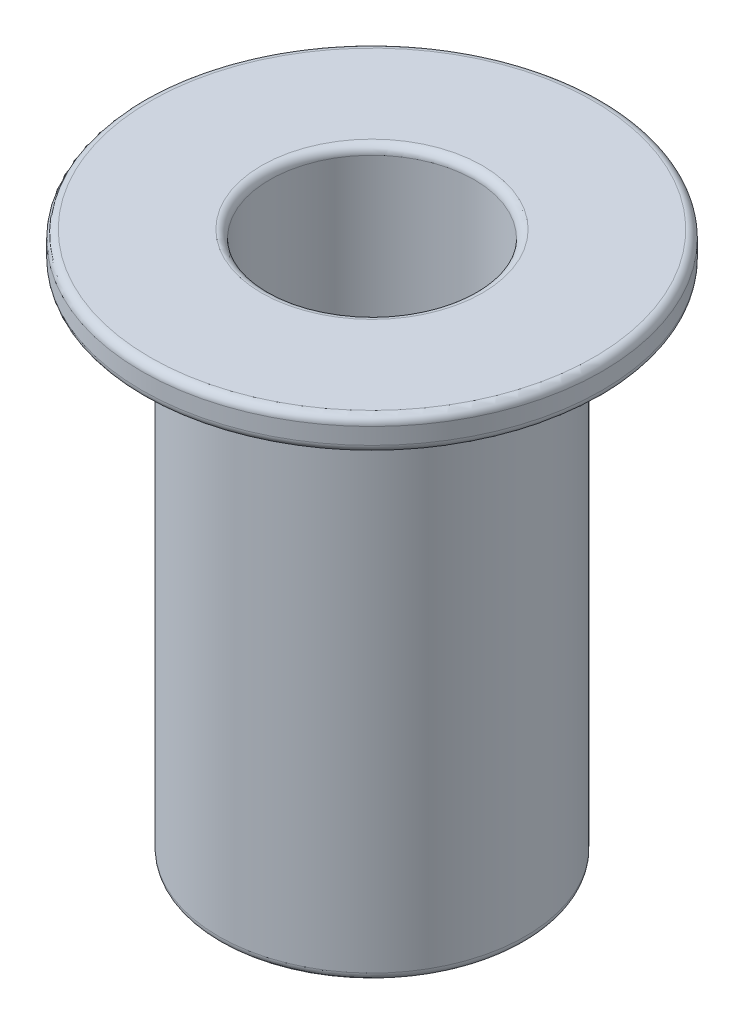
SolidWorks part; units mm, degrees
ref_plane "Front" through (0, 0, 0) normal (0, 0, 1) x (1, 0, 0)
ref_plane "Top" through (0, 0, 0) normal (0, 1, 0) x (1, 0, 0)
ref_plane "Right" through (0, 0, 0) normal (1, 0, 0) x (0, 0, -1)
sketch "Sketch1" plane through (0, 0, 0) normal (0, 1, 0) x (1, 0, 0)
  circle A0 centre (0, 0) radius 7.1438
  dimension "D1" = 14.2875
extrude "Base-Extrude" add sketch "Sketch1" along normal blind 1.016
sketch "Sketch2" plane through (0, 0, 0) normal (0, -1, 0) x (1, 0, 0)
  circle A0 centre (0, 0) radius 4.7625
  dimension "D1" = 9.525
extrude "Boss-Extrude1" add sketch "Sketch2" along normal blind 15.875
sketch "Sketch3" plane through (0, 1.016, 0) normal (0, 1, 0) x (-1, 0, 0)
  circle A0 centre (0, 0) radius 3.175
  dimension "D1" = 6.35
extrude "Cut-Extrude1" cut sketch "Sketch3" against normal blind 9.525
hole_wizard "#10-32 Tapped Hole1" positions "Sketch5" profile "Sketch4" tap size "#10-32" standard "Ansi Inch"
sketch "Sketch5" plane through (0, -8.509, 0) normal (0, 1, 0) x (-1, 0, 0)
  point P0 (0, 0)
sketch "Sketch4" plane through (0, -8.509, 0) normal (1, 0, 0) x (0, 0, 1)
  line L0 (0, 0) -> (0, 7.366)
  line L1 (0, 7.366) -> (2.0193, 7.366)
  line L3 (2.0193, 7.366) -> (2.0193, 9.652)
  line L4 (2.0193, 9.652) -> (2.413, 9.652)
  line L5 (2.413, 9.652) -> (2.413, 0)
  line L7 (2.413, 0) -> (0, 0)
  line L11 (0, -6.35) -> (0, 107.95) construction
  dimension "Thru Tap Drill Dia." = 4.0386
  dimension "Thru Tap Drill Depth" = 7.366
  dimension "Thread Dia." = 4.826
  dimension "Thread Depth" = 9.652
fillet "Fillet1" radius 0.254
